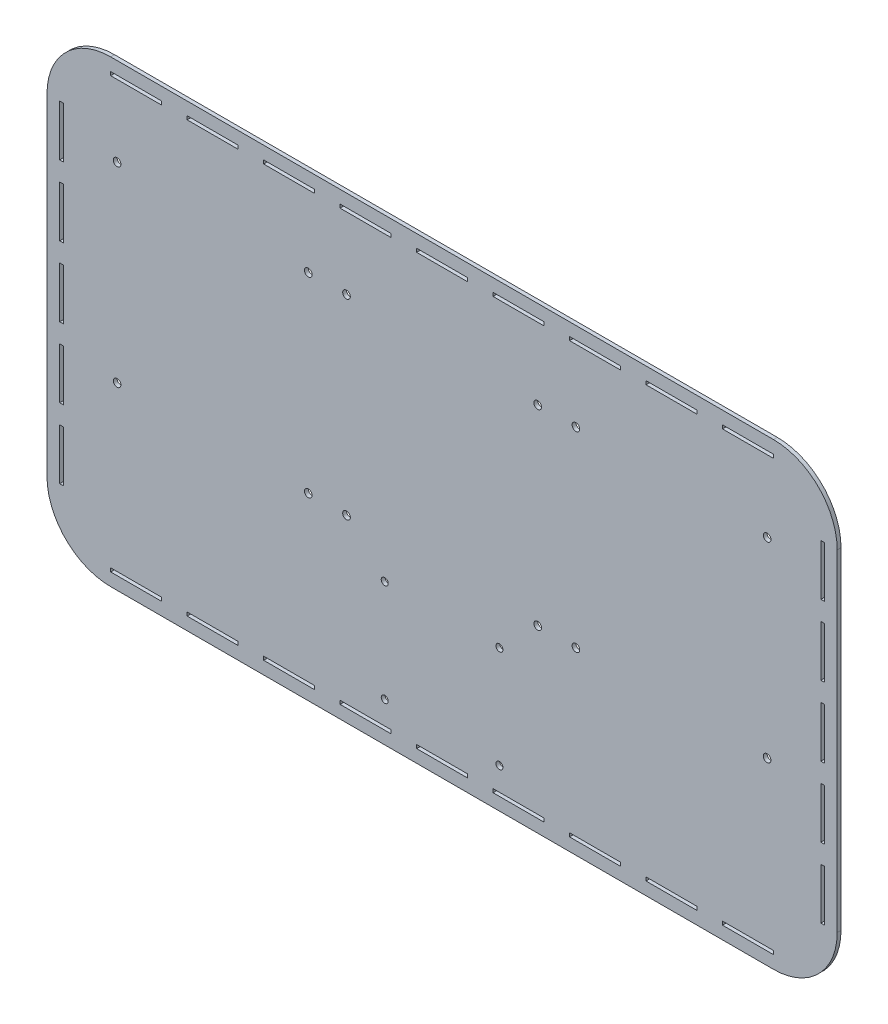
SolidWorks part; units mm, degrees
ref_plane "Front Plane" through (0, 0, 0) normal (0, 0, 1) x (1, 0, 0)
ref_plane "Top Plane" through (0, 0, 0) normal (0, 1, 0) x (1, 0, 0)
ref_plane "Right Plane" through (0, 0, 0) normal (1, 0, 0) x (0, 0, -1)
sketch "Sketch1" plane through (0, 0, 0) normal (0, 0, 1) x (1, 0, 0)
  line L1 (260, -180) -> (-260, -180)
  line L2 (310, -130) -> (310, 130)
  line L3 (260, 180) -> (-260, 180)
  line L4 (-310, -130) -> (-310, 130)
  line L5 (310, -180) -> (-310, 180) construction
  line L6 (310, 180) -> (-310, -180) construction
  arc A0 (310, 130) -> (260, 180) centre (260, 130) ccw
  arc A1 (260, -180) -> (310, -130) centre (260, -130) ccw
  arc A2 (-260, -180) -> (-310, -130) centre (-260, -130) cw
  arc A3 (-260, 180) -> (-310, 130) centre (-260, 130) ccw
  point P0 (0, 0)
  dimension "D3" = 50
  dimension "D1" = 620
  dimension "D2" = 360
extrude "Boss-Extrude1" add sketch "Sketch1" along normal blind 3
sketch "Sketch2" plane through (0, 0, 3) normal (0, 0, 1) x (1, 0, 0)
  line L0 (0, 180) -> (0, -180) construction
  line L1 (75, -49) -> (3, -49)
  line L2 (85, -39) -> (85, 111)
  line L3 (75, 121) -> (-75, 121)
  line L4 (-85, -39) -> (-85, 111)
  line L5 (85, -49) -> (-85, 121) construction
  line L6 (85, 121) -> (-85, -49) construction
  line L7 (260, 180) -> (-260, 180) construction
  line L8 (-260, -180) -> (260, -180) construction
  line L9 (105, 121) -> (255, 121)
  line L10 (-105, -49) -> (-255, -49)
  line L11 (-95, -39) -> (-95, 111)
  line L12 (-105, 121) -> (-255, 121)
  line L13 (-265, -39) -> (-265, 111)
  line L14 (-95, -49) -> (-265, 121) construction
  line L15 (-95, 121) -> (-265, -49) construction
  line L16 (265, -39) -> (265, 111)
  line L17 (105, -49) -> (255, -49)
  line L18 (95, -39) -> (95, 111)
  line L19 (105, 158) -> (275, 158)
  line L20 (45, -59) -> (3, -59)
  line L21 (55, -69) -> (55, -149)
  line L22 (45, -159) -> (-45, -159)
  line L23 (-55, -69) -> (-55, -149)
  line L24 (55, -59) -> (-55, -159) construction
  line L25 (55, -159) -> (-55, -59) construction
  line L26 (-105, 141) -> (-275, 141)
  line L27 (-100, 146) -> (-100, 153)
  line L28 (-105, 158) -> (-275, 158)
  line L29 (-280, 146) -> (-280, 153)
  line L30 (-100, 141) -> (-280, 158) construction
  line L31 (-100, 158) -> (-280, 141) construction
  line L32 (85, 141) -> (-85, 141)
  line L33 (90, 146) -> (90, 153)
  line L34 (85, 158) -> (-85, 158)
  line L35 (-90, 146) -> (-90, 153)
  line L36 (90, 141) -> (-90, 158) construction
  line L37 (90, 158) -> (-90, 141) construction
  line L38 (280, 146) -> (280, 153)
  line L39 (105, 141) -> (275, 141)
  line L40 (100, 146) -> (100, 153)
  line L42 (-3, -49) -> (-75, -49)
  line L44 (-3, -49) -> (-3, -59)
  line L46 (3, -49) -> (3, -59)
  line L47 (-3, -59) -> (-45, -59)
  arc A0 (-45, -159) -> (-55, -149) centre (-45, -149) cw
  arc A1 (55, -149) -> (45, -159) centre (45, -149) cw
  arc A2 (45, -59) -> (55, -69) centre (45, -69) cw
  arc A3 (-45, -59) -> (-55, -69) centre (-45, -69) ccw
  arc A4 (265, -39) -> (255, -49) centre (255, -39) cw
  arc A5 (255, 121) -> (265, 111) centre (255, 111) cw
  arc A6 (105, 121) -> (95, 111) centre (105, 111) ccw
  arc A7 (105, -49) -> (95, -39) centre (105, -39) cw
  arc A8 (-75, -49) -> (-85, -39) centre (-75, -39) cw
  arc A9 (75, -49) -> (85, -39) centre (75, -39) ccw
  arc A10 (85, 111) -> (75, 121) centre (75, 111) ccw
  arc A11 (-75, 121) -> (-85, 111) centre (-75, 111) ccw
  arc A12 (-95, 111) -> (-105, 121) centre (-105, 111) ccw
  arc A13 (-105, -49) -> (-95, -39) centre (-105, -39) ccw
  arc A14 (-255, -49) -> (-265, -39) centre (-255, -39) cw
  arc A15 (-255, 121) -> (-265, 111) centre (-255, 111) ccw
  arc A16 (280, 146) -> (275, 141) centre (275, 146) cw
  arc A17 (275, 158) -> (280, 153) centre (275, 153) cw
  arc A18 (105, 158) -> (100, 153) centre (105, 153) ccw
  arc A19 (105, 141) -> (100, 146) centre (105, 146) cw
  arc A20 (85, 141) -> (90, 146) centre (85, 146) ccw
  arc A21 (90, 153) -> (85, 158) centre (85, 153) ccw
  arc A22 (-85, 158) -> (-90, 153) centre (-85, 153) ccw
  arc A23 (-85, 141) -> (-90, 146) centre (-85, 146) cw
  arc A24 (-105, 141) -> (-100, 146) centre (-105, 146) ccw
  arc A25 (-100, 153) -> (-105, 158) centre (-105, 153) ccw
  arc A26 (-275, 158) -> (-280, 153) centre (-275, 153) ccw
  arc A27 (-275, 141) -> (-280, 146) centre (-275, 146) cw
  point P0 (0, 36)
  point P13 (-180, 36)
  point P22 (0, -109)
  point P40 (265, -49)
  point P43 (265, 121)
  point P46 (95, 121)
  point P49 (95, -49)
  point P74 (-190, 149.5)
  point P80 (0, 149.5)
  point P94 (280, 141)
  point P97 (280, 158)
  point P100 (100, 158)
  point P103 (100, 141)
  dimension "D8" = 10
  dimension "D18" = 5
  dimension "D1" = 170
  dimension "D2" = 170
  dimension "D3" = 170
  dimension "D4" = 170
  dimension "D5" = 10
  dimension "D6" = 110
  dimension "D7" = 100
  dimension "D9" = 17
  dimension "D10" = 180
  dimension "D11" = 17
  dimension "D12" = 180
  dimension "D13" = 20
  dimension "D14" = 10
  dimension "D15" = 22
  dimension "D16" = 6
  dimension "D17" = 3
  dimension "D19" = 10
sketch "Sketch5" plane through (0, 0, 3) normal (0, 0, 1) x (1, 0, 0)
  line L0 (-310, 130) -> (-310, -130) construction
  line L1 (-300, 130) -> (-297.2, 130)
  line L2 (-300, 130) -> (-300, 90)
  line L3 (-300, 90) -> (-297.2, 90)
  line L4 (-297.2, 130) -> (-297.2, 90)
  line L5 (-300, 75) -> (-300, 35)
  line L6 (-300, 75) -> (-297.2, 75)
  line L7 (-297.2, 75) -> (-297.2, 35)
  line L8 (-300, 35) -> (-297.2, 35)
  line L9 (-300, 20) -> (-300, -20)
  line L10 (-300, 20) -> (-297.2, 20)
  line L11 (-297.2, 20) -> (-297.2, -20)
  line L12 (-300, -20) -> (-297.2, -20)
  line L13 (-300, -35) -> (-300, -75)
  line L14 (-300, -35) -> (-297.2, -35)
  line L15 (-297.2, -35) -> (-297.2, -75)
  line L16 (-300, -75) -> (-297.2, -75)
  line L17 (-300, -90) -> (-300, -130)
  line L18 (-300, -90) -> (-297.2, -90)
  line L19 (-297.2, -90) -> (-297.2, -130)
  line L20 (-300, -130) -> (-297.2, -130)
  line L21 (-260, -180) -> (260, -180) construction
  line L58 (-310, 0) -> (310, 0) construction
  line L59 (310, -130) -> (310, 130) construction
  line L60 (0, 180) -> (0, -180) construction
  line L61 (260, 180) -> (-260, 180) construction
  line L62 (300, -90) -> (297.2, -90)
  line L63 (297.2, -90) -> (297.2, -130)
  line L64 (300, -130) -> (297.2, -130)
  line L65 (300, -90) -> (300, -130)
  line L66 (300, -35) -> (297.2, -35)
  line L67 (297.2, -35) -> (297.2, -75)
  line L68 (300, -75) -> (297.2, -75)
  line L69 (300, -35) -> (300, -75)
  line L70 (300, 20) -> (297.2, 20)
  line L71 (297.2, 20) -> (297.2, -20)
  line L72 (300, -20) -> (297.2, -20)
  line L73 (300, 20) -> (300, -20)
  line L74 (300, 75) -> (297.2, 75)
  line L75 (297.2, 75) -> (297.2, 35)
  line L76 (300, 35) -> (297.2, 35)
  line L77 (300, 75) -> (300, 35)
  line L78 (300, 90) -> (297.2, 90)
  line L79 (297.2, 130) -> (297.2, 90)
  line L80 (300, 130) -> (297.2, 130)
  line L81 (300, 130) -> (300, 90)
  line L114 (-260, 167.2) -> (-220, 167.2)
  line L115 (-220, 170) -> (-220, 167.2)
  line L116 (-260, 170) -> (-220, 170)
  line L117 (-260, 170) -> (-260, 167.2)
  line L118 (-200, 167.2) -> (-160, 167.2)
  line L119 (-160, 170) -> (-160, 167.2)
  line L120 (-200, 170) -> (-160, 170)
  line L121 (-200, 170) -> (-200, 167.2)
  line L122 (-140, 167.2) -> (-100, 167.2)
  line L123 (-100, 170) -> (-100, 167.2)
  line L124 (-140, 170) -> (-100, 170)
  line L125 (-140, 170) -> (-140, 167.2)
  line L126 (-80, 167.2) -> (-40, 167.2)
  line L127 (-40, 170) -> (-40, 167.2)
  line L128 (-80, 170) -> (-40, 170)
  line L129 (-80, 170) -> (-80, 167.2)
  line L130 (-20, 167.2) -> (20, 167.2)
  line L131 (20, 170) -> (20, 167.2)
  line L132 (-20, 170) -> (20, 170)
  line L133 (-20, 170) -> (-20, 167.2)
  line L134 (40, 167.2) -> (80, 167.2)
  line L135 (80, 170) -> (80, 167.2)
  line L136 (40, 170) -> (80, 170)
  line L137 (40, 170) -> (40, 167.2)
  line L138 (100, 167.2) -> (140, 167.2)
  line L139 (140, 170) -> (140, 167.2)
  line L140 (100, 170) -> (140, 170)
  line L141 (100, 170) -> (100, 167.2)
  line L142 (160, 167.2) -> (200, 167.2)
  line L143 (200, 170) -> (200, 167.2)
  line L144 (160, 170) -> (200, 170)
  line L145 (160, 170) -> (160, 167.2)
  line L146 (220, 167.2) -> (260, 167.2)
  line L147 (260, 170) -> (260, 167.2)
  line L148 (220, 170) -> (260, 170)
  line L149 (220, 170) -> (220, 167.2)
  line L150 (220, -170) -> (220, -167.2)
  line L151 (220, -170) -> (260, -170)
  line L152 (260, -170) -> (260, -167.2)
  line L153 (220, -167.2) -> (260, -167.2)
  line L154 (160, -170) -> (160, -167.2)
  line L155 (160, -170) -> (200, -170)
  line L156 (200, -170) -> (200, -167.2)
  line L157 (160, -167.2) -> (200, -167.2)
  line L158 (100, -170) -> (100, -167.2)
  line L159 (100, -170) -> (140, -170)
  line L160 (140, -170) -> (140, -167.2)
  line L161 (100, -167.2) -> (140, -167.2)
  line L162 (40, -170) -> (40, -167.2)
  line L163 (40, -170) -> (80, -170)
  line L164 (80, -170) -> (80, -167.2)
  line L165 (40, -167.2) -> (80, -167.2)
  line L166 (-20, -170) -> (-20, -167.2)
  line L167 (-20, -170) -> (20, -170)
  line L168 (20, -170) -> (20, -167.2)
  line L169 (-20, -167.2) -> (20, -167.2)
  line L170 (-80, -170) -> (-80, -167.2)
  line L171 (-80, -170) -> (-40, -170)
  line L172 (-40, -170) -> (-40, -167.2)
  line L173 (-80, -167.2) -> (-40, -167.2)
  line L174 (-140, -170) -> (-140, -167.2)
  line L175 (-140, -170) -> (-100, -170)
  line L176 (-100, -170) -> (-100, -167.2)
  line L177 (-140, -167.2) -> (-100, -167.2)
  line L178 (-200, -170) -> (-200, -167.2)
  line L179 (-200, -170) -> (-160, -170)
  line L180 (-160, -170) -> (-160, -167.2)
  line L181 (-200, -167.2) -> (-160, -167.2)
  line L182 (-260, -170) -> (-260, -167.2)
  line L183 (-260, -170) -> (-220, -170)
  line L184 (-220, -170) -> (-220, -167.2)
  line L185 (-260, -167.2) -> (-220, -167.2)
  dimension "D1" = 2.8
  dimension "D2" = 40
  dimension "D3" = 10
  dimension "D4" = 0
  dimension "D6" = 10
  dimension "D7" = 50
  dimension "D8" = 2.8
  dimension "D9" = 40
  dimension "D5" = 5
  dimension "D10" = 9
extrude "Cut-Extrude4" cut sketch "Sketch5" against normal blind 3
sketch "Sketch6" plane through (0, 0, 3) normal (0, 0, 1) x (1, 0, 0)
  line L5 (0, 180) -> (0, -180) construction
  line L6 (-260, -180) -> (260, -180) construction
  circle A12 centre (-45, -69) radius 2.75
  circle A13 centre (-45, -149) radius 2.75
  circle A14 centre (45, -149) radius 2.75
  circle A15 centre (45, -69) radius 2.75
  circle A16 centre (-255, 111) radius 3
  circle A17 centre (-255, -39) radius 3
  circle A18 centre (-105, 111) radius 3
  circle A19 centre (-105, -39) radius 3
  circle A20 centre (-75, -39) radius 3
  circle A21 centre (-75, 111) radius 3
  circle A22 centre (75, 111) radius 3
  circle A23 centre (75, -39) radius 3
  circle A24 centre (105, 111) radius 3
  circle A25 centre (105, -39) radius 3
  circle A26 centre (255, -39) radius 3
  circle A27 centre (255, 111) radius 3
  dimension "D1" = 6
  dimension "D4" = 6
  dimension "D5" = 6
  dimension "D6" = 6
  dimension "D7" = 5.5
  dimension "D8" = 5.5
  dimension "D2" = 6
  dimension "D3" = 6
extrude "Cut-Extrude5" cut sketch "Sketch6" against normal blind 10
